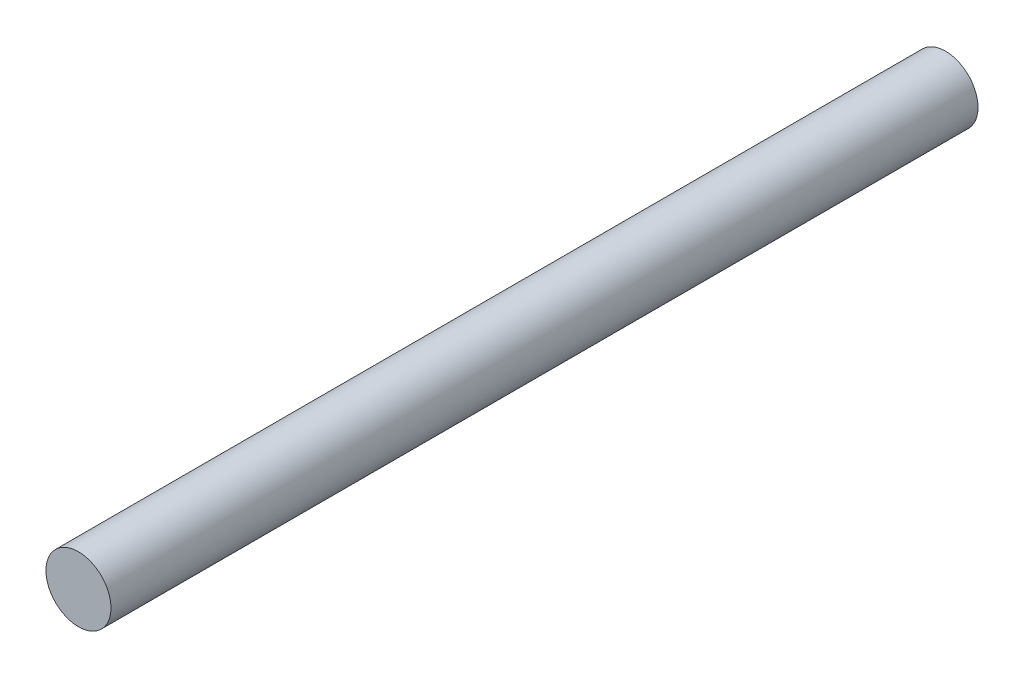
SolidWorks part; units mm, degrees
ref_plane "Front Plane" through (0, 0, 0) normal (0, 0, 1) x (1, 0, 0)
ref_plane "Top Plane" through (0, 0, 0) normal (0, 1, 0) x (1, 0, 0)
ref_plane "Right Plane" through (0, 0, 0) normal (1, 0, 0) x (0, 0, -1)
sketch "Sketch1" plane through (0, 0, 0) normal (0, 0, 1) x (1, 0, 0)
  circle A0 centre (0, 0) radius 30
  dimension "D1" = 60
extrude "Boss-Extrude1" add sketch "Sketch1" against normal blind 800
